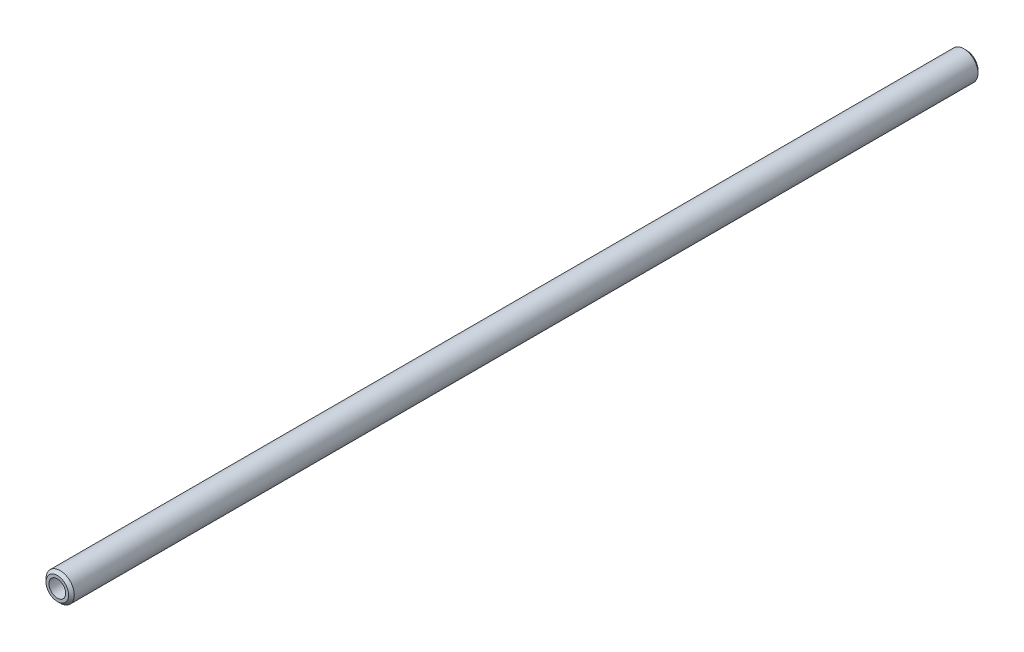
SolidWorks part; units mm, degrees
ref_plane "Front" through (0, 0, 0) normal (0, 0, 1) x (1, 0, 0)
ref_plane "Top" through (0, 0, 0) normal (0, 1, 0) x (1, 0, 0)
ref_plane "Right" through (0, 0, 0) normal (1, 0, 0) x (0, 0, -1)
sketch "Sketch1" plane through (0, 0, 0) normal (0, 0, 1) x (1, 0, 0)
  circle A0 centre (0, 0) radius 1.5
extrude "Extrude1" add sketch "Sketch1" along normal blind 96.5
sketch "Sketch2" plane through (0, 0, 0) normal (1, 0, 0) x (0, 0, -1)
  point P0 (-96.5, 1.5)
  point P1 (0, 1.5)
chamfer "Chamfer1" distance 0.3 angle 45 2 edges at (1.5, 0, 0) (1.5, 0, 96.5)
sketch "Sketch3" plane through (0, 0, 96.5) normal (0, 0, 1) x (1, 0, 0)
  point P0 (0, 0)
hole_wizard "Tap Drill for #2-56 Tap1" positions "Sketch4" profile "Sketch5" hole size "#2-56" standard "ANSI Inch"
sketch "Sketch4" plane through (0, 0, 96.5) normal (0, 0, 1) x (1, 0, 0)
  point P0 (0, 0)
sketch "Sketch5" plane through (0, 0, 96.5) normal (1, 0, 0) x (0, -1, 0)
  line L0 (0, 0) -> (0, 6.5342)
  line L1 (0, 6.5342) -> (0.889, 6)
  line L2 (0.889, 6) -> (0.889, 0)
  line L5 (0.889, 0) -> (0, 0)
  line L10 (0, 6.5342) -> (-0.889, 6) construction
  line L11 (0, -6.35) -> (0, 107.95) construction
  dimension "Hole Dia." = 1.778
  dimension "Hole Depth" = 6
  dimension "Drill Angle" = 118
ref_plane "Plane1" through (0, 0, 48.25) normal (0, 0, 1) x (1, 0, 0)
mirror "Mirror1" about plane through (0, 0, 48.25) normal (0, 0, 1) of "Tap Drill for #2-56 Tap1"
equation "\"D1@Chamfer1\" = \"dia@Sketch1\" * .1"
